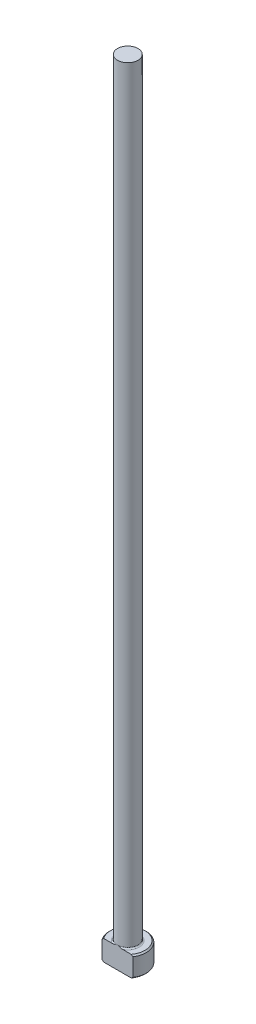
SolidWorks part; units mm, degrees
ref_plane "Front Plane" through (0, 0, 0) normal (0, 0, 1) x (1, 0, 0)
ref_plane "Top Plane" through (0, 0, 0) normal (0, 1, 0) x (1, 0, 0)
ref_plane "Right Plane" through (0, 0, 0) normal (1, 0, 0) x (0, 0, -1)
sketch "Sketch1" plane through (0, 0, 0) normal (0, 0, 1) x (1, 0, 0)
  line L0 (0, 259.9588) -> (0, -15.1925) construction
  line L1 (0, 0) -> (-3.5687, 0)
  line L2 (-3.5687, 0) -> (-3.5687, 3.9624)
  line L3 (-3.5687, 3.9624) -> (-1.9837, 3.9624)
  line L4 (-1.9837, 3.9624) -> (-1.9837, 152.4)
  line L5 (-1.9837, 152.4) -> (0, 152.4)
  line L6 (0, 152.4) -> (0, 0)
  dimension "L" = 152.4
  dimension "H" = 7.1374
  dimension "T" = 3.9624
  dimension "D" = 3.9675
revolve "Revolve1" add sketch "Sketch1" angle 360 about L0
chamfer "Chamfer1" distance 0.254 angle 45 2 edges at (0, 3.9624, 3.5687) (0, 0, 3.5687)
fillet "Fillet1" radius 0.254 1 edges at (0, 3.9624, 1.9837)
sketch "Sketch2" plane through (0, 0, 0) normal (0, -1, 0) x (1, 0, 0)
  line L0 (-2.9665, 1.9837) -> (2.9665, 1.9837)
  arc A0 (2.9665, 1.9837) -> (-2.9665, 1.9837) centre (0, 0) ccw
  circle A1 centre (0, 0) radius 3.5687 construction
  circle A3 centre (0, 0) radius 1.9837 construction
extrude "KEY" cut sketch "Sketch2" against normal through all
sketch "Pocket Sketch" plane through (0, 0, 0) normal (0, 0, 1) x (1, 0, 0)
  line L0 (-3.9656, 0) -> (-3.9656, 3.9878)
  line L1 (-3.9656, 3.9878) -> (-2.9442, 3.9878)
  line L2 (-2.1822, 4.7498) -> (-2.1822, 22.225)
  line L3 (-2.1822, 22.225) -> (0, 22.225)
  line L4 (0, 22.225) -> (0, 0)
  line L5 (0, 0) -> (-3.9656, 0)
  line L6 (0, 12.6104) -> (0, -2.4989) construction
  line L7 (-3.5687, 3.7084) -> (-3.5687, 0.254) construction
  line L8 (3.3147, 3.9624) -> (-3.3147, 3.9624) construction
  line L9 (-1.9837, 152.4) -> (-1.9837, 4.2164) construction
  line L10 (-2.9442, 3.9878) -> (-2.1822, 4.7498)
  point P3 (-2.1822, 3.9878)
  dimension "D1" = 7.9311
  dimension "D2" = 0.3969
  dimension "D3" = 0.0254
  dimension "D4" = 0.1984
  dimension "D5" = 4.3644
  dimension "D6" = 22.225
